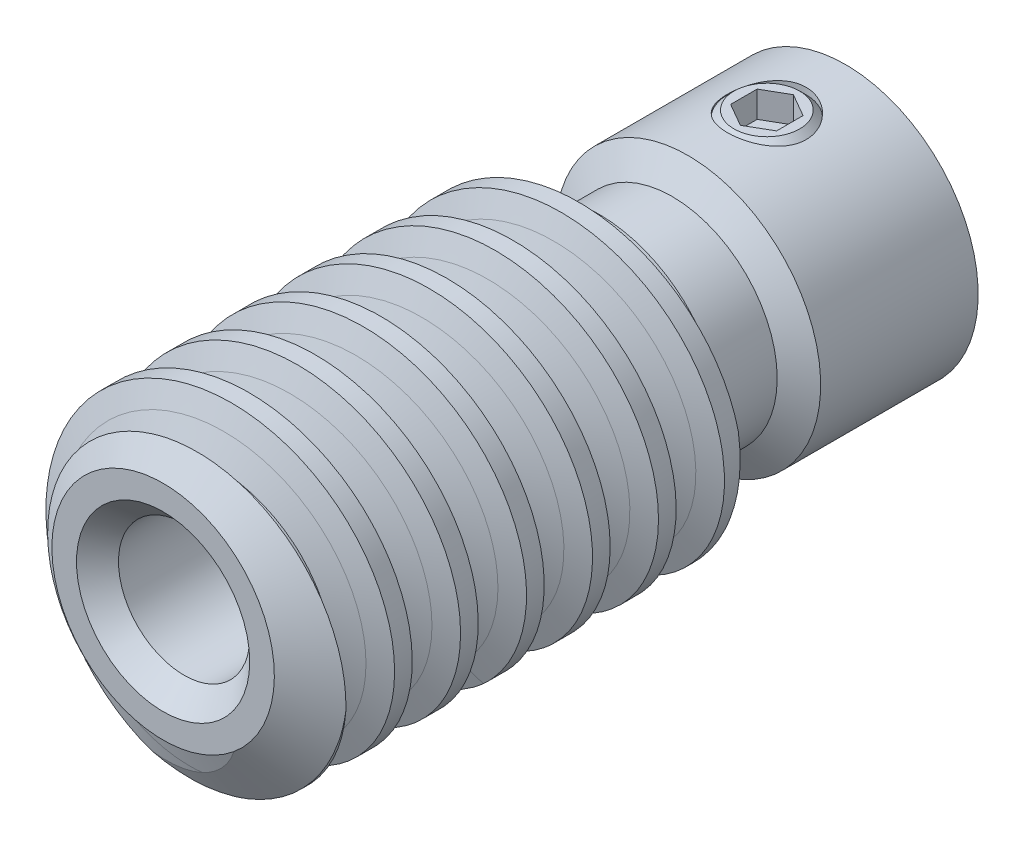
SolidWorks part; units mm, degrees
ref_plane "Front Plane" through (0, 0, 0) normal (0, 0, 1) x (1, 0, 0)
ref_plane "Top Plane" through (0, 0, 0) normal (0, 1, 0) x (1, 0, 0)
ref_plane "Right Plane" through (0, 0, 0) normal (1, 0, 0) x (0, 0, -1)
imported_body "Imported1"
scale "Scale1" scale about centroid uniform scaling yes scale factor 0.5
